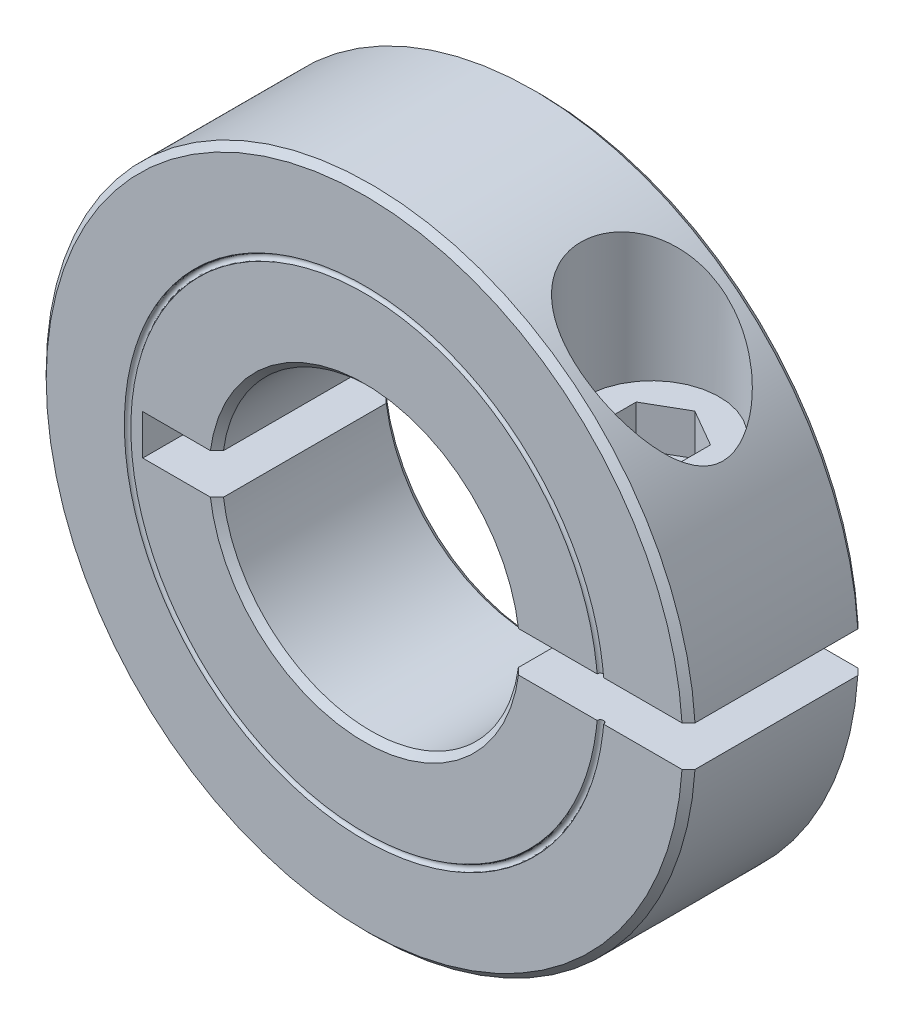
SolidWorks part; units mm, degrees
other "LUMP1"
ref_plane "Front" through (0, 0, 0) normal (0, 0, 1) x (1, 0, 0)
ref_plane "Top" through (0, 0, 0) normal (0, 1, 0) x (1, 0, 0)
ref_plane "Right" through (0, 0, 0) normal (1, 0, 0) x (0, 0, -1)
imported_body "Imported1"
move or copy body "Body-Move/Copy1" bodies to move or copy 101 placed by mates yes
ref_plane "Z Location" through (0, 0, 57.3684) normal (0, 0, 1) x (1, 0, 0)
sketch "Y Location" plane through (0, 0, 57.3684) normal (0, 0, 1) x (1, 0, 0)
  line L0 (0, 0) -> (0, 191.8513) construction
  dimension "BD71" = 191.8513
move or copy body "Body-Move/Copy2" bodies to move or copy 101 placed by mates yes
other "Distance1" parameters "D1"=5.1562
